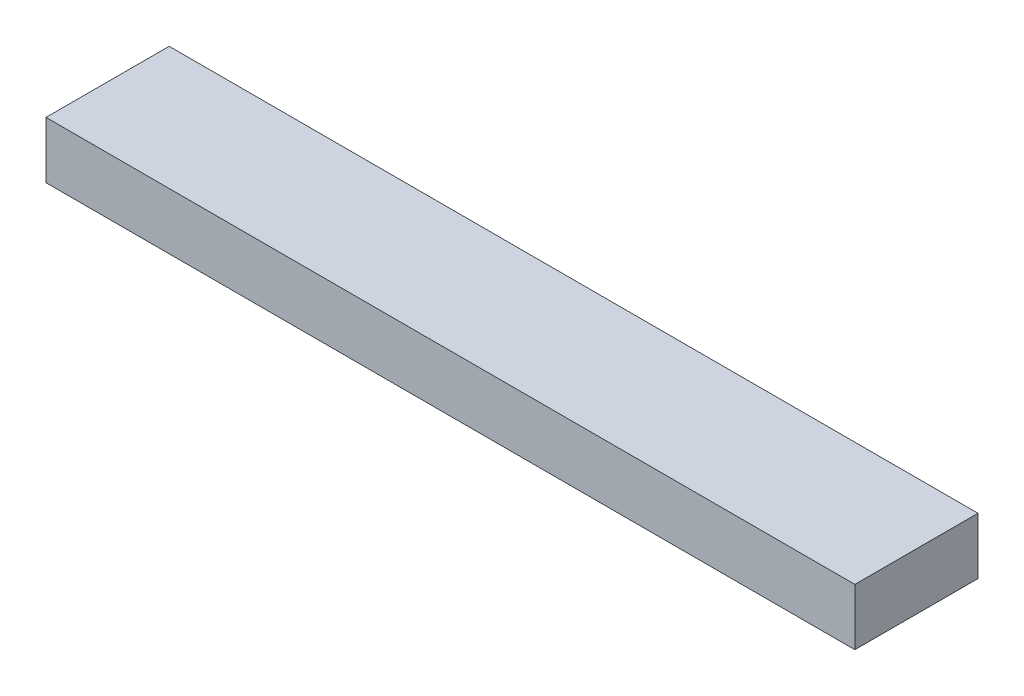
SolidWorks part; units mm, degrees
ref_plane "Front" through (0, 0, 0) normal (0, 0, 1) x (1, 0, 0)
ref_plane "Top" through (0, 0, 0) normal (0, 1, 0) x (1, 0, 0)
ref_plane "Right" through (0, 0, 0) normal (1, 0, 0) x (0, 0, -1)
sketch "Esquisse1" plane through (0, 0, 0) normal (0, 0, 1) x (1, 0, 0)
  line L1 (121.5, -8.5) -> (-121.5, -8.5)
  line L2 (121.5, -8.5) -> (121.5, 8.5)
  line L3 (121.5, 8.5) -> (-121.5, 8.5)
  line L4 (-121.5, -8.5) -> (-121.5, 8.5)
  line L5 (121.5, -8.5) -> (-121.5, 8.5) construction
  line L6 (121.5, 8.5) -> (-121.5, -8.5) construction
  point P0 (0, 0)
  dimension "D1" = 243
  dimension "D2" = 17
extrude "Boss.-Extru.1" add sketch "Esquisse1" along normal blind 37
